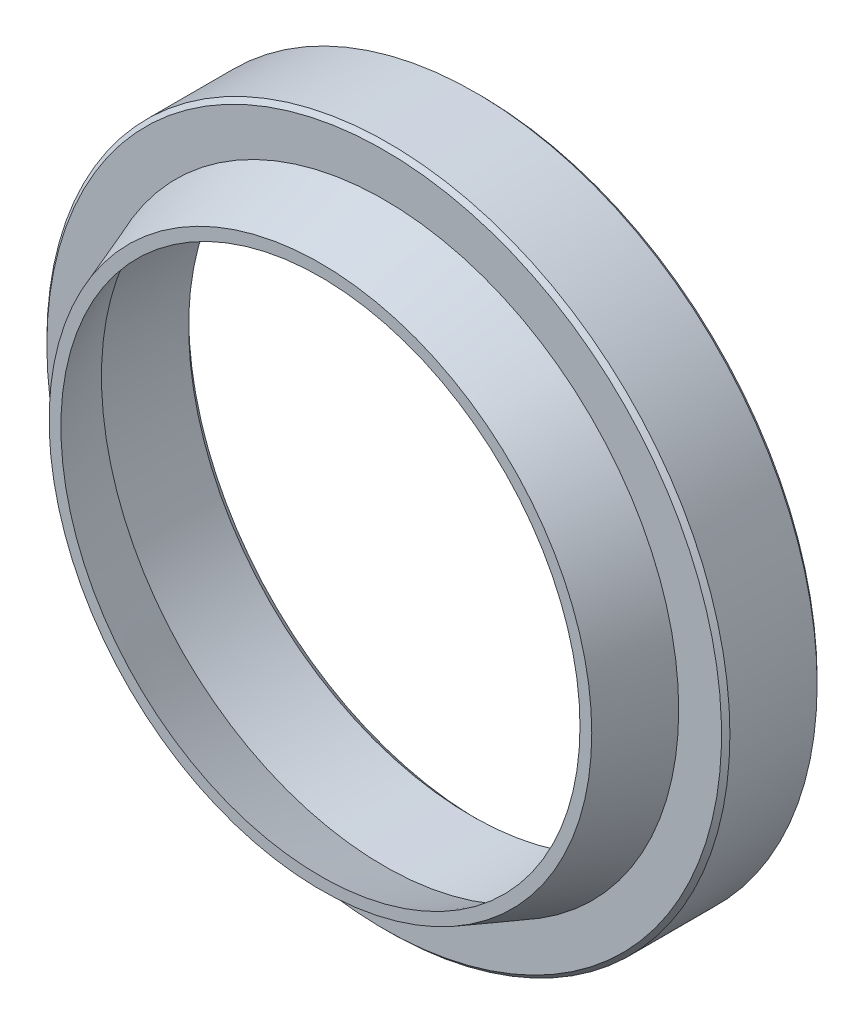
SolidWorks part; units mm, degrees
ref_plane "Front" through (0, 0, 0) normal (0, 0, 1) x (1, 0, 0)
ref_plane "Top" through (0, 0, 0) normal (0, 1, 0) x (1, 0, 0)
ref_plane "Right" through (0, 0, 0) normal (1, 0, 0) x (0, 0, -1)
other "Configuration Table"
sketch "Sketch1" plane through (25, 0, -4.5162) normal (0, 1, 0) x (-1, 0, 0)
  line L0 (25, 9.1959) -> (25, -4.6797) construction
  line L1 (45.7, -7.1505) -> (45.7, -0.1545)
  line L2 (45.7, -7.1505) -> (50, -7.1505)
  line L3 (45.7, -0.1545) -> (44, 4.5162)
  line L4 (46.56, -0.1505) -> (50, -0.1505)
  line L5 (50, -7.1505) -> (50, -0.1505)
  line L6 (44, 4.5162) -> (44.8615, 4.5162)
  line L7 (44.8615, 4.5162) -> (46.56, -0.1505)
revolve "Body" add sketch "Sketch1" angle 360 about L0
chamfer "EndChamfer" distance 0.6143 angle 45 1 edges at (20.7, 0, -11.6667)
chamfer "BodyChamfer" distance 0.3071 angle 45 2 edges at (25, 0, -4.6667) (25, 0, -11.6667)
equation "\"D7@Sketch1\" = 2*\"h@Sketch1\" / 3"
equation "\"D6@Sketch1\" = \"S@Sketch1\" / 5"
equation "\"D1@EndChamfer\" = \"S@Sketch1\" / 7"
equation "\"D1@BodyChamfer\" = \"S@Sketch1\" / 14"
